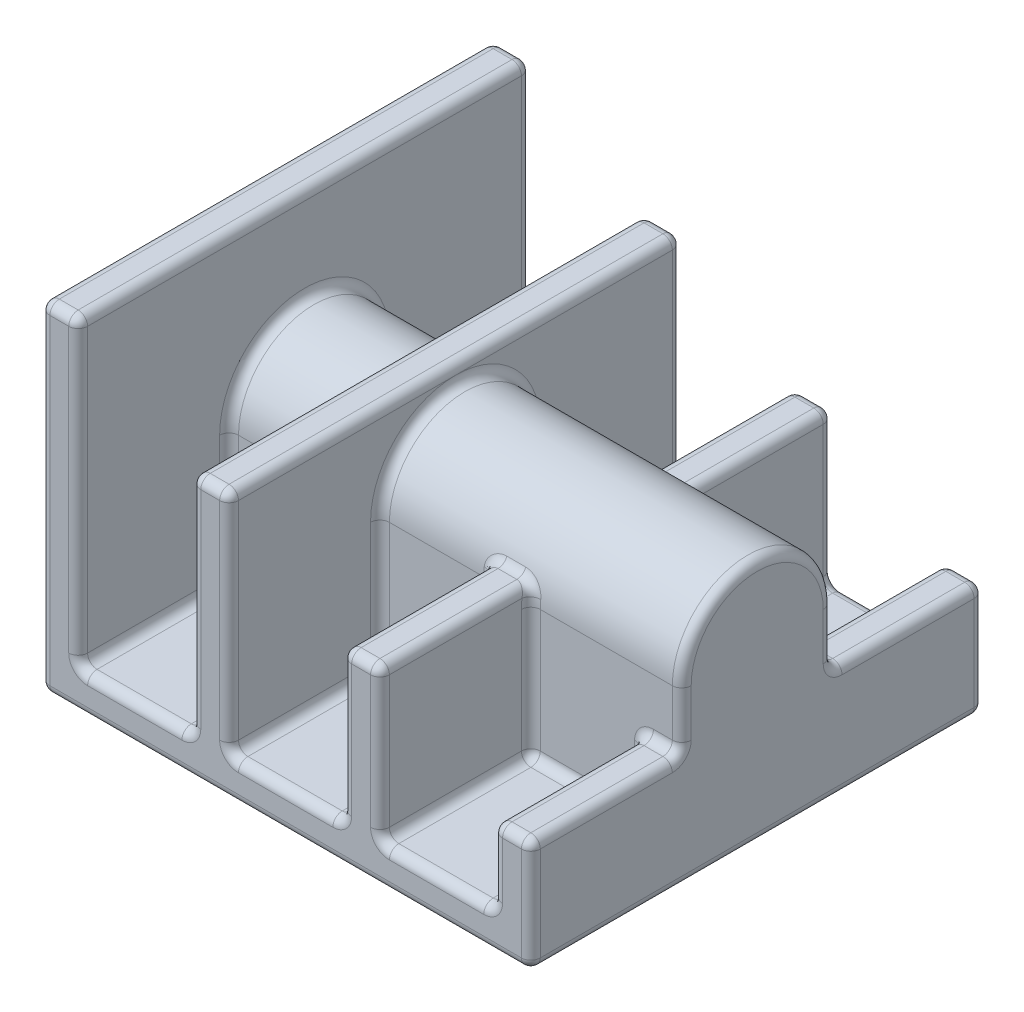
SolidWorks part; units mm, degrees
ref_plane "Front Plane" through (0, 0, 0) normal (0, 0, 1) x (1, 0, 0)
ref_plane "Top Plane" through (0, 0, 0) normal (0, 1, 0) x (1, 0, 0)
ref_plane "Right Plane" through (0, 0, 0) normal (1, 0, 0) x (0, 0, -1)
sketch "Sketch1" plane through (0, 0, 0) normal (0, 0, 1) x (1, 0, 0)
  line L0 (0, 0) -> (0, 114.3)
  line L1 (0, 114.3) -> (12.7, 114.3)
  line L2 (12.7, 114.3) -> (12.7, 12.7)
  line L3 (12.7, 12.7) -> (50.8, 12.7)
  line L4 (50.8, 12.7) -> (50.8, 88.9)
  line L5 (50.8, 88.9) -> (63.5, 88.9)
  line L6 (63.5, 88.9) -> (63.5, 12.7)
  line L7 (63.5, 12.7) -> (101.6, 12.7)
  line L8 (101.6, 12.7) -> (101.6, 63.5)
  line L9 (101.6, 63.5) -> (114.3, 63.5)
  line L10 (114.3, 63.5) -> (114.3, 12.7)
  line L11 (114.3, 12.7) -> (152.4, 12.7)
  line L12 (152.4, 12.7) -> (152.4, 38.1)
  line L13 (152.4, 38.1) -> (165.1, 38.1)
  line L14 (165.1, 38.1) -> (165.1, 0)
  line L15 (165.1, 0) -> (0, 0)
  dimension "D1" = 12.7
  dimension "D2" = 50.8
  dimension "D3" = 165.1
  dimension "D4" = 101.6
  dimension "D5" = 12.7
  dimension "D6" = 38.1
  dimension "D7" = 63.5
  dimension "D8" = 88.9
  dimension "D9" = 114.3
extrude "Boss-Extrude1" add sketch "Sketch1" against normal blind 152.4
sketch "Sketch2" plane through (12.7, 0, 0) normal (1, 0, 0) x (0, 0, -1)
  line L0 (152.4, 114.3) -> (0, 114.3) construction
  line L1 (0, 12.7) -> (0, 114.3) construction
  line L2 (101.6, 57.15) -> (101.6, 12.7)
  line L3 (152.4, 12.7) -> (0, 12.7) construction
  line L4 (101.6, 12.7) -> (50.8, 12.7)
  line L5 (50.8, 12.7) -> (50.8, 57.15)
  arc A0 (101.6, 57.15) -> (50.8, 57.15) centre (76.2, 57.15) ccw
  dimension "D1" = 50.8
  dimension "D2" = 57.15
  dimension "D3" = 76.2
extrude "Boss-Extrude2" add sketch "Sketch2" along normal through all
fillet "Fillet1" radius 3.175 90 edges at (114.3, 60.3505, -51.0024) (114.3, 60.3505, -101.3976) (0, 0, -76.2) (0, 114.3, -76.2) (12.7, 114.3, -76.2) (12.7, 12.7, -127) (12.7, 12.7, -25.4) (50.8, 12.7, -127) (50.8, 12.7, -25.4) (50.8, 88.9, -76.2) (63.5, 88.9, -76.2) (63.5, 12.7, -127) (63.5, 12.7, -25.4) (101.6, 12.7, -127) (101.6, 12.7, -25.4) (101.6, 63.5, -126.5967) (101.6, 63.5, -25.8033) (114.3, 63.5, -126.5967) (114.3, 63.5, -25.8033) (114.3, 12.7, -127) (114.3, 12.7, -25.4) (152.4, 12.7, -127) (152.4, 12.7, -25.4) (152.4, 38.1, -127) (152.4, 38.1, -25.4) (165.1, 38.1, -127) (165.1, 38.1, -25.4) (165.1, 0, -76.2) (0, 57.15, -152.4) (6.35, 114.3, -152.4) (12.7, 63.5, -152.4) (31.75, 12.7, -152.4) (50.8, 50.8, -152.4) (57.15, 88.9, -152.4) (63.5, 50.8, -152.4) (82.55, 12.7, -152.4) (101.6, 38.1, -152.4) (107.95, 63.5, -152.4) (114.3, 38.1, -152.4) (133.35, 12.7, -152.4) (152.4, 25.4, -152.4) (158.75, 38.1, -152.4) (165.1, 19.05, -152.4) (82.55, 0, -152.4) (0, 57.15, 0) (6.35, 114.3, 0) (12.7, 63.5, 0) (31.75, 12.7, 0) (50.8, 50.8, 0) (57.15, 88.9, 0) (63.5, 50.8, 0) (82.55, 12.7, 0) (101.6, 38.1, 0) (107.95, 63.5, 0) (114.3, 38.1, 0) (133.35, 12.7, 0) (152.4, 25.4, 0) (158.75, 38.1, 0) (165.1, 19.05, 0) (82.55, 0, 0) (50.8, 82.55, -76.2) (63.5, 82.55, -76.2) (101.6, 60.3505, -51.0024) (107.95, 63.5, -51.6066) (107.95, 63.5, -100.7934) (101.6, 60.3505, -101.3976) (50.8, 34.925, -50.8) (63.5, 34.925, -50.8) (101.6, 34.925, -50.8) (114.3, 34.925, -50.8) (152.4, 25.4, -50.8) (158.75, 38.1, -50.8) (50.8, 34.925, -101.6) (63.5, 34.925, -101.6) (101.6, 34.925, -101.6) (114.3, 34.925, -101.6) (152.4, 25.4, -101.6) (158.75, 38.1, -101.6) (133.35, 12.7, -50.8) (82.55, 12.7, -50.8) (31.75, 12.7, -50.8) (133.35, 12.7, -101.6) (82.55, 12.7, -101.6) (31.75, 12.7, -101.6) (165.1, 47.625, -101.6) (165.1, 47.625, -50.8) (12.7, 82.55, -76.2) (165.1, 82.55, -76.2) (12.7, 34.925, -101.6) (12.7, 34.925, -50.8)
